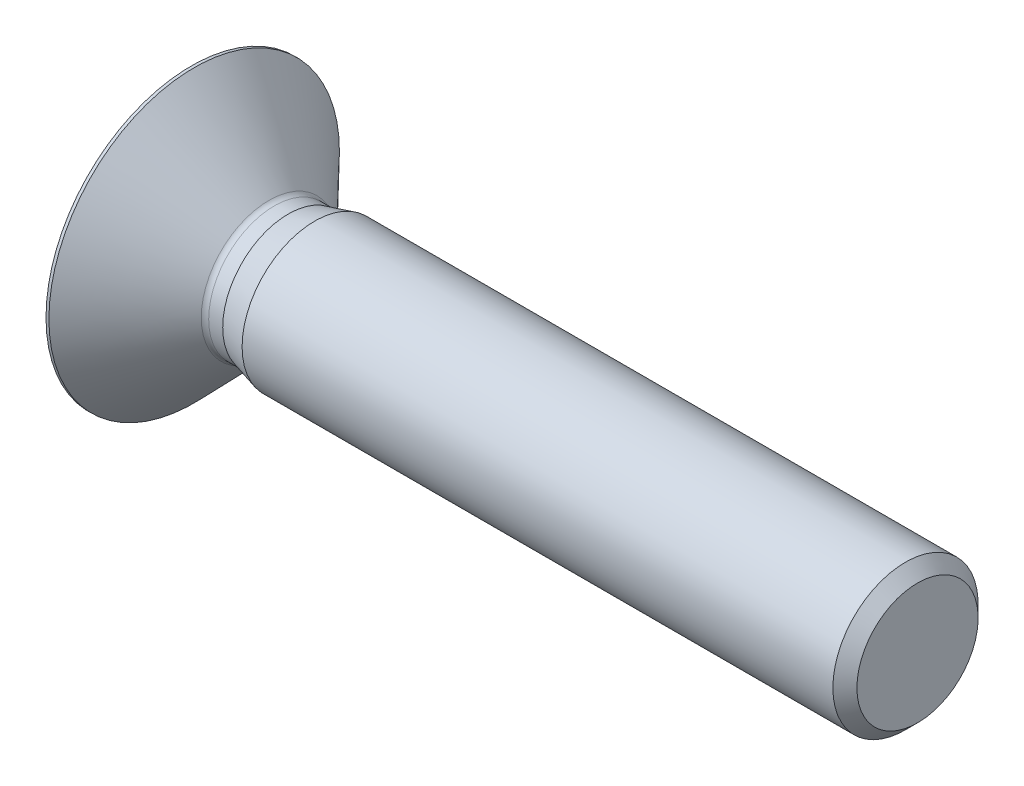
SolidWorks part; units mm, degrees
ref_plane "Front Plane" through (0, 0, 0) normal (0, 0, 1) x (1, 0, 0)
ref_plane "Top Plane" through (0, 0, 0) normal (0, 1, 0) x (1, 0, 0)
ref_plane "Right Plane" through (0, 0, 0) normal (1, 0, 0) x (0, 0, -1)
other "Configuration Table"
sketch "BodySke" plane through (0, 0, 0) normal (0, 0, 1) x (1, 0, 0)
  line L0 (0, 0) -> (88.9981, 0) construction
  line L1 (0, 0) -> (0, 10)
  line L2 (0, 10) -> (0.2, 10)
  line L3 (0.2, 10) -> (5.5, 4.5117)
  line L4 (5.5, 4.5117) -> (6.6776, 4.5117)
  line L5 (6.6776, 4.5117) -> (8.5, 5)
  line L6 (8.5, 5) -> (49.172, 5)
  line L7 (50, 4.172) -> (50, 0)
  line L8 (50, 0) -> (0, 0)
  line L9 (48.5, 0) -> (48.5, 7.7079) construction
  line L10 (49.172, 5) -> (50, 4.172)
  line L11 (0.2, -10) -> (5.5, -4.5117) construction
revolve "BaseBody" add sketch "BodySke" angle 360 about L0
fillet "Fillet1" radius 0.5 1 edges at (5.5, 0, 4.5117)
sketch "HexSke" plane through (0, 0, 0) normal (1, 0, 0) x (0, 0, -1)
  line L1 (0, 3.4641) -> (-3, 1.7321)
  line L2 (-3, 1.7321) -> (-3, -1.7321)
  line L3 (-3, -1.7321) -> (0, -3.4641)
  line L4 (0, -3.4641) -> (3, -1.7321)
  line L5 (3, -1.7321) -> (3, 1.7321)
  line L6 (3, 1.7321) -> (0, 3.4641)
  circle A0 centre (0, 0) radius 3 construction
extrude "Hex" cut sketch "HexSke" along normal blind 4.4
sketch "Hex-PreBroachSke" plane through (0, 0, 0) normal (0, 0, 1) x (1, 0, 0)
  line L0 (0, 0) -> (21.7825, 0) construction
  line L1 (0, 10) -> (0, -10) construction
  line L2 (0, 0) -> (0, 3)
  line L3 (0, 3) -> (4.4, 3)
  line L4 (4.4, 3) -> (6.1321, 0)
  line L5 (6.1321, 0) -> (0, 0)
revolve "Hex-PreBroach" cut sketch "Hex-PreBroachSke" angle 360 about L0
sketch "ThdSchSke" plane through (0, 0, 0) normal (0, 0, 1) x (1, 0, 0)
  line L0 (0, 0) -> (51.4372, 0) construction
  line L1 (0, 10) -> (0, -10) construction
  line L2 (47.672, 5.9561) -> (47.672, 5)
  line L3 (47.672, 5.9561) -> (48.6281, 5.9561)
  line L4 (48.6281, 5.9561) -> (48.6281, 5)
  line L5 (48.6281, 5) -> (48.15, 4.172)
  line L6 (48.15, 4.172) -> (47.672, 5)
revolve "ThreadSchematic" [suppressed] cut sketch "ThdSchSke" angle 360 about L0
pattern_linear "ThdSchPat" [suppressed]
equation "\"D5@BodySke\" = 2 * \"Advance@BodySke\""
equation "\"Thread_minor@ThreadCosmetic\" = \"Thread_minor@BodySke\""
equation "\"D1@Hex-PreBroachSke\" = \"Hex_width@HexSke\""
equation "\"D2@Hex-PreBroachSke\" = \"Hex_depth@Hex\""
equation "\"D1@ThdSchSke\" = \"Advance@BodySke\""
equation "\"Advance@ThdSchPat\" = \"Advance@BodySke\""
equation "\"Tooth_Num@ThdSchPat\" =  int( (  \"Length@BodySke\" - \"Head_length@BodySke\" - \"D5@BodySke\" )  / \"Advance@BodySke\" ) "
